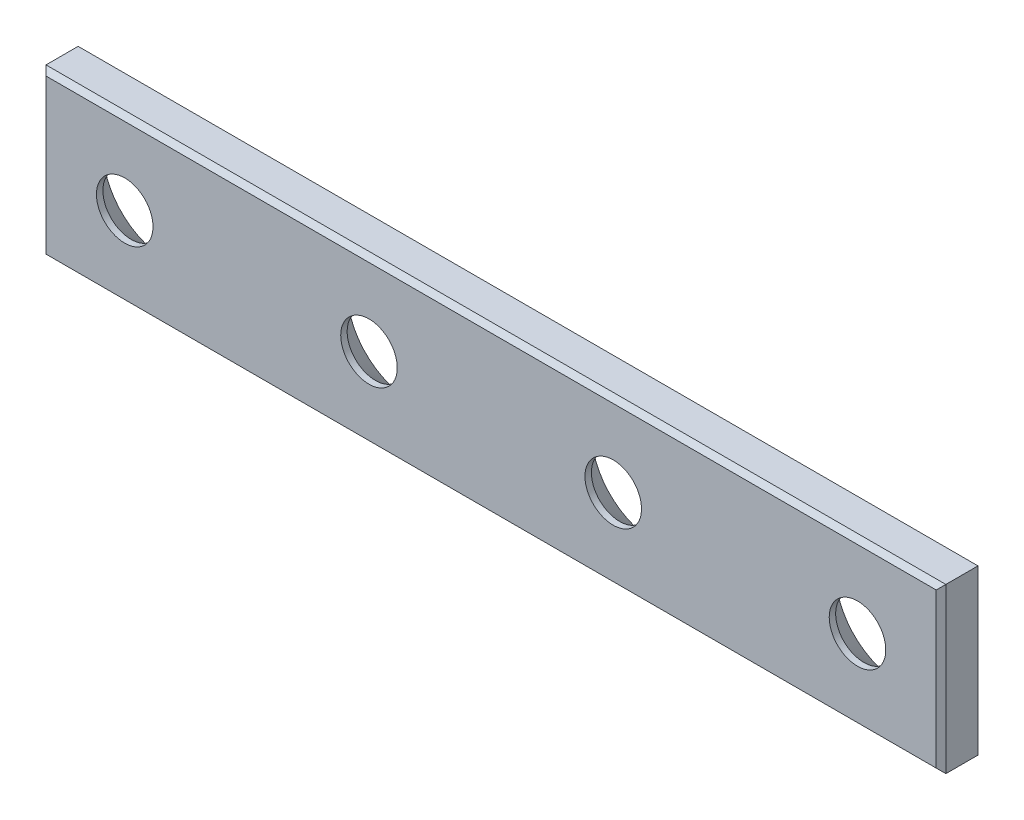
SolidWorks part; units mm, degrees
ref_plane "Front Plane" through (0, 0, 0) normal (0, 0, 1) x (1, 0, 0)
ref_plane "Top Plane" through (0, 0, 0) normal (0, 1, 0) x (1, 0, 0)
ref_plane "Right Plane" through (0, 0, 0) normal (1, 0, 0) x (0, 0, -1)
sketch "Sketch1" plane through (0, 0, 0) normal (0, 0, 1) x (1, 0, 0)
  line L1 (-70, -12.75) -> (70, -12.75)
  line L2 (-70, -12.75) -> (-70, 12.75)
  line L3 (-70, 12.75) -> (70, 12.75)
  line L4 (70, -12.75) -> (70, 12.75)
  line L5 (-70, -12.75) -> (70, 12.75) construction
  line L6 (-70, 12.75) -> (70, -12.75) construction
  point P0 (0, 0)
  dimension "D1" = 140
  dimension "D2" = 25.5
extrude "Extrude1" add sketch "Sketch1" along normal blind 6.5
chamfer "Chamfer1" distance 0.75 angle 45 8 edges at (0, -12.75, 6.5) (-70, 0, 6.5) (0, 12.75, 6.5) (70, 0, 6.5) (0, 12.75, 0) (-70, 0, 0) (0, -12.75, 0) (70, 0, 0)
sketch "Sketch3" plane through (0, 0, 0) normal (0, 0, -1) x (-1, 0, 0)
  line L0 (-76.5427, 0) -> (82.2034, 0) construction
  circle A0 centre (57, 0) radius 4.4
  circle A1 centre (19, 0) radius 4.4
  circle A2 centre (-19, 0) radius 4.4
  circle A3 centre (-57, 0) radius 4.4
  dimension "D1" = 8.8
  dimension "D2" = 8.8
  dimension "D3" = 8.8
  dimension "D4" = 8.8
  dimension "D5" = 19
  dimension "D6" = 19
  dimension "D7" = 57
  dimension "D8" = 57
extrude "Cut-Extrude1" cut sketch "Sketch3" against normal through all
chamfer "Chamfer2" distance 5.5 angle 45 4 edges at (52.6, 0, 0) (-61.4, 0, 0) (-23.4, 0, 0) (14.6, 0, 0)
